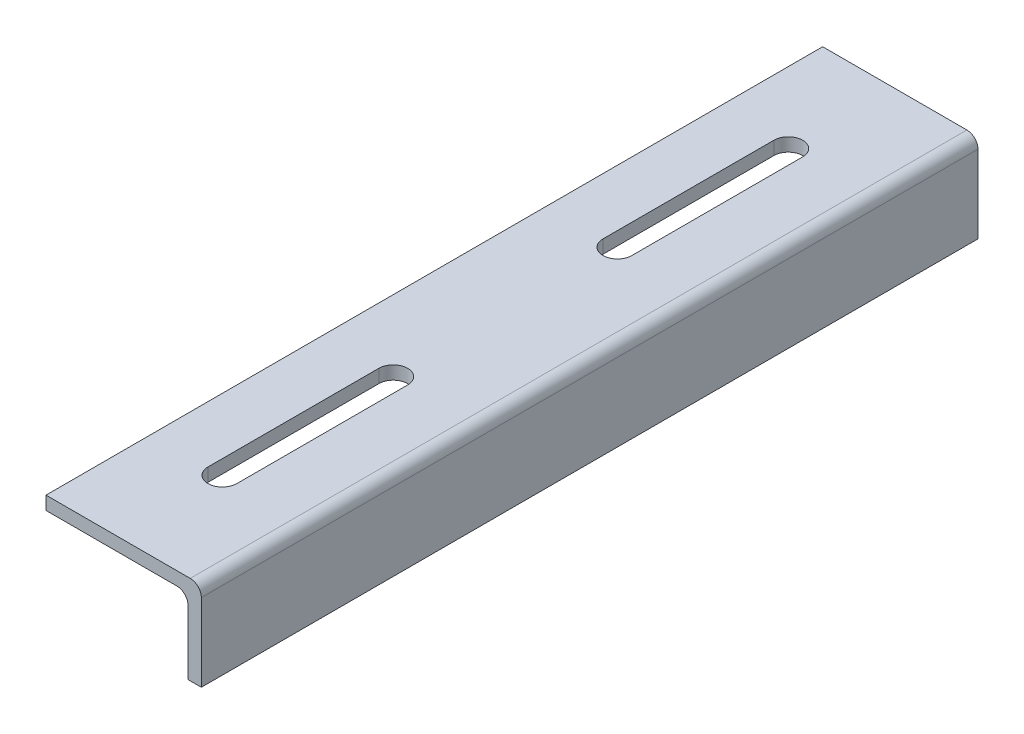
SolidWorks part; units mm, degrees
ref_plane "前视基准面" through (0, 0, 0) normal (0, 0, 1) x (1, 0, 0)
ref_plane "上视基准面" through (0, 0, 0) normal (0, 1, 0) x (1, 0, 0)
ref_plane "右视基准面" through (0, 0, 0) normal (1, 0, 0) x (0, 0, -1)
sketch "草图1" plane through (0, 0, 0) normal (0, 0, 1) x (1, 0, 0)
  line L0 (-70, 0) -> (0, 0)
  line L1 (0, 0) -> (0, -40)
  line L2 (0, -40) -> (-6, -40)
  line L3 (-6, -40) -> (-6, -6)
  line L4 (-6, -6) -> (-70, -6)
  line L5 (-70, -6) -> (-70, 0)
  dimension "D1" = 70
  dimension "D2" = 40
  dimension "D3" = 6
  dimension "D4" = 6
extrude "拉伸1" add sketch "草图1" along normal blind 350
sketch "草图2" plane through (0, 0, 0) normal (0, 1, 0) x (-1, 0, 0)
  line L0 (38, -41.0935) -> (38, 397.0023) construction
  line L1 (70, 350) -> (70, 0) construction
  line L2 (31.5, 225.5) -> (31.5, 302.5)
  line L3 (44.5, 225.5) -> (44.5, 302.5)
  line L4 (0, 350) -> (70, 350) construction
  arc A0 (44.5, 302.5) -> (31.5, 302.5) centre (38, 302.5) ccw
  arc A1 (31.5, 225.5) -> (44.5, 225.5) centre (38, 225.5) ccw
  dimension "D2" = 13
  dimension "D3" = 13
  dimension "D4" = 41
  dimension "D5" = 77
  dimension "D1" = 32
extrude "切除-拉伸1" cut sketch "草图2" against normal blind 350
pattern_linear "阵列(线性)1" count 2 spacing 178 along (0, 0, -1) of "切除-拉伸1"
fillet "圆角1" radius 5 2 edges at (-6, -6, 175) (0, 0, 175)
